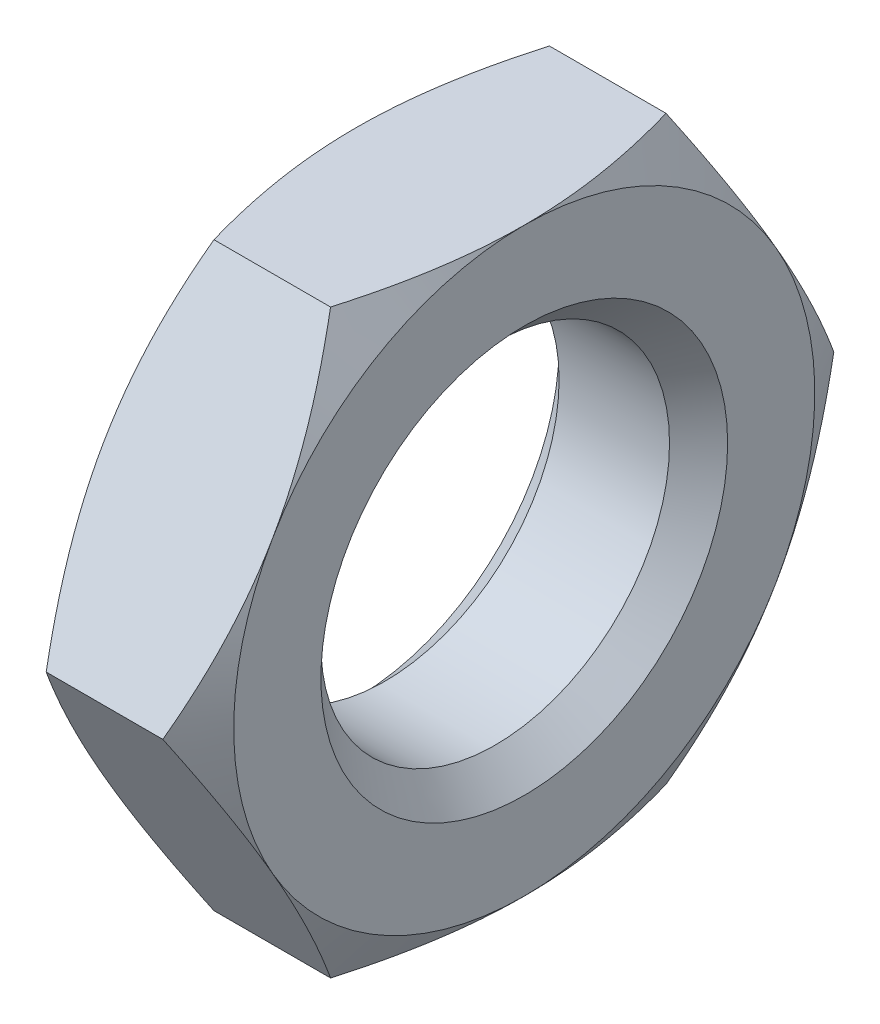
SolidWorks part; units mm, degrees
ref_plane "Front Plane" through (0, 0, 0) normal (0, 0, 1) x (1, 0, 0)
ref_plane "Top Plane" through (0, 0, 0) normal (0, 1, 0) x (1, 0, 0)
ref_plane "Right Plane" through (0, 0, 0) normal (1, 0, 0) x (0, 0, -1)
sketch "Sketch1" plane through (0, 0, 0) normal (1, 0, 0) x (0, 0, -1)
  line L1 (2.8868, 5) -> (-2.8868, 5)
  line L2 (-2.8868, 5) -> (-5.7735, 0)
  line L3 (-5.7735, 0) -> (-2.8868, -5)
  line L4 (-2.8868, -5) -> (2.8868, -5)
  line L5 (2.8868, -5) -> (5.7735, 0)
  line L6 (5.7735, 0) -> (2.8868, 5)
  circle A0 centre (0, 0) radius 5 construction
  circle A1 centre (0, 0) radius 3
extrude "Extrude1" add sketch "Sketch1" along normal blind 2.9
sketch "Sketch2" plane through (0, 0, 0) normal (0, 0, 1) x (1, 0, 0)
  line L0 (2.9, 5) -> (2.9, 20)
  line L1 (2.9, 20) -> (0, 20)
  line L2 (0, 20) -> (0, 5)
  line L3 (0, 5) -> (1.45, 7.5115)
  line L4 (1.45, 7.5115) -> (2.9, 5)
revolve "Cut-Revolve1" cut sketch "Sketch2" angle 360 about axis through (2.9, 0, 0) along (-1, 0, 0)
chamfer "Chamfer1" distance 0.5 angle 45 2 edges at (0, 0, -3) (2.9, 0, -3)
equation "\"D2@Sketch2\"=\"D1@Sketch1\"*2"
